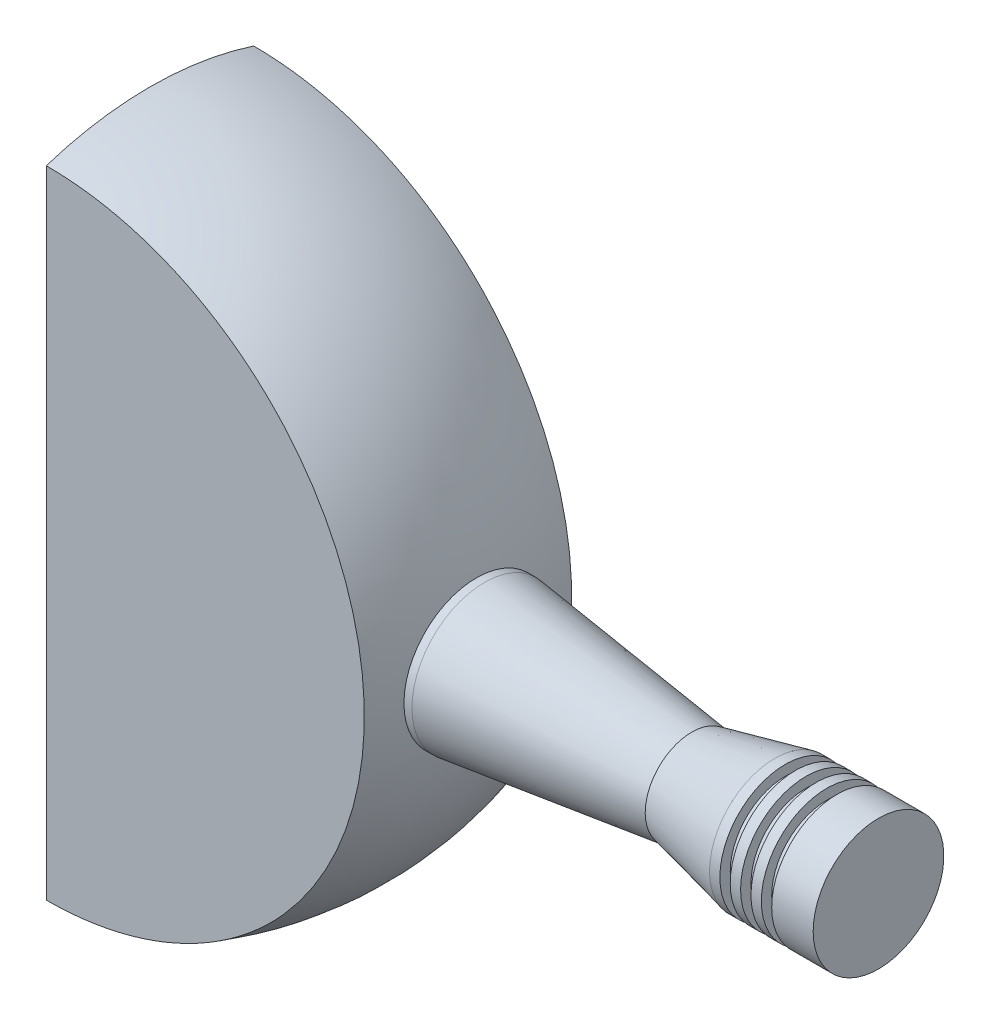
SolidWorks part; units mm, degrees
ref_plane "Plan de face" through (0, 0, 0) normal (0, 0, 1) x (1, 0, 0)
ref_plane "Plan de dessus" through (0, 0, 0) normal (0, 1, 0) x (1, 0, 0)
ref_plane "Plan de droite" through (0, 0, 0) normal (1, 0, 0) x (0, 0, -1)
sketch "Esquisse1" plane through (0, 0, 0) normal (0, 0, 1) x (1, 0, 0)
  line L0 (0, 23.1956) -> (0, -17.46) construction
  line L1 (0, 16.13) -> (0, -16.13)
  arc A0 (0, -16.13) -> (0, 16.13) centre (0, 0) ccw
  dimension "D1" = 32.26
revolve "Révolution5" add sketch "Esquisse1" angle 360 about L0
sketch "Esquisse2" plane through (0, 0, 0) normal (0, 0, 1) x (1, 0, 0)
  line L0 (0, 16.13) -> (0, -16.13)
  circle A0 centre (0, 0) radius 16.13 construction
extrude "Enlèv. mat.-Extru.1" cut sketch "Esquisse2" against normal through all and the other way through all flip side to cut
sketch "Esquisse4" plane through (0, 0, 0) normal (0, 0, 1) x (1, 0, 0)
  line L0 (0, 0) -> (35.13, 0) construction
  line L1 (15.1571, 0) -> (35.13, 0)
  line L2 (16.13, -7.635) -> (16.13, 5.9741) construction
  line L3 (26.13, 2.25) -> (16.13, 3.5)
  line L4 (16.13, 3.5) -> (15.1571, 3.5)
  line L5 (26.13, 2.25) -> (30.13, 3.15)
  line L6 (30.13, 3.15) -> (30.63, 3.15)
  line L7 (15.1571, 3.5) -> (15.1571, 0)
  line L8 (31.13, 3.15) -> (31.63, 3.15)
  line L9 (35.13, 3.15) -> (35.13, 0)
  line L10 (33.13, 3.15) -> (35.13, 3.15)
  line L11 (32.63, 3.15) -> (32.63, 2.65)
  line L12 (32.63, 2.65) -> (33.13, 2.65)
  line L13 (33.13, 3.15) -> (33.13, 2.65)
  line L15 (31.63, 3.15) -> (31.63, 2.65)
  line L16 (31.63, 2.65) -> (32.13, 2.65)
  line L17 (32.13, 3.15) -> (32.13, 2.65)
  line L18 (32.13, 3.15) -> (32.63, 3.15)
  line L19 (30.63, 3.15) -> (30.63, 2.65)
  line L20 (30.63, 2.65) -> (31.13, 2.65)
  line L21 (31.13, 3.15) -> (31.13, 2.65)
  arc A0 (0, -16.13) -> (0, 16.13) centre (0, 0) ccw construction
  dimension "D1" = 19
  dimension "D2" = 6.3
  dimension "D3" = 5
  dimension "D4" = 4
  dimension "D5" = 4.5
  dimension "D6" = 7
  dimension "D7" = 0.5
  dimension "D8" = 0.5
  dimension "D9" = 0.5
  dimension "D10" = 0.5
  dimension "D11" = 2
revolve "Révolution6" add sketch "Esquisse4" angle 360 about L0
sketch "Esquisse5" plane through (0, 0, 0) normal (1, 0, 0) x (0, 0, -1)
  line L1 (-5, 17.1185) -> (5, 17.1185)
  line L2 (-5, 17.1185) -> (-5, -17.065)
  line L3 (-5, -17.065) -> (5, -17.065)
  line L4 (5, 17.1185) -> (5, -17.065)
  dimension "D1" = 5
  dimension "D2" = 5
extrude "Enlèv. mat.-Extru.2" cut sketch "Esquisse5" against normal mid plane 80 flip side to cut
